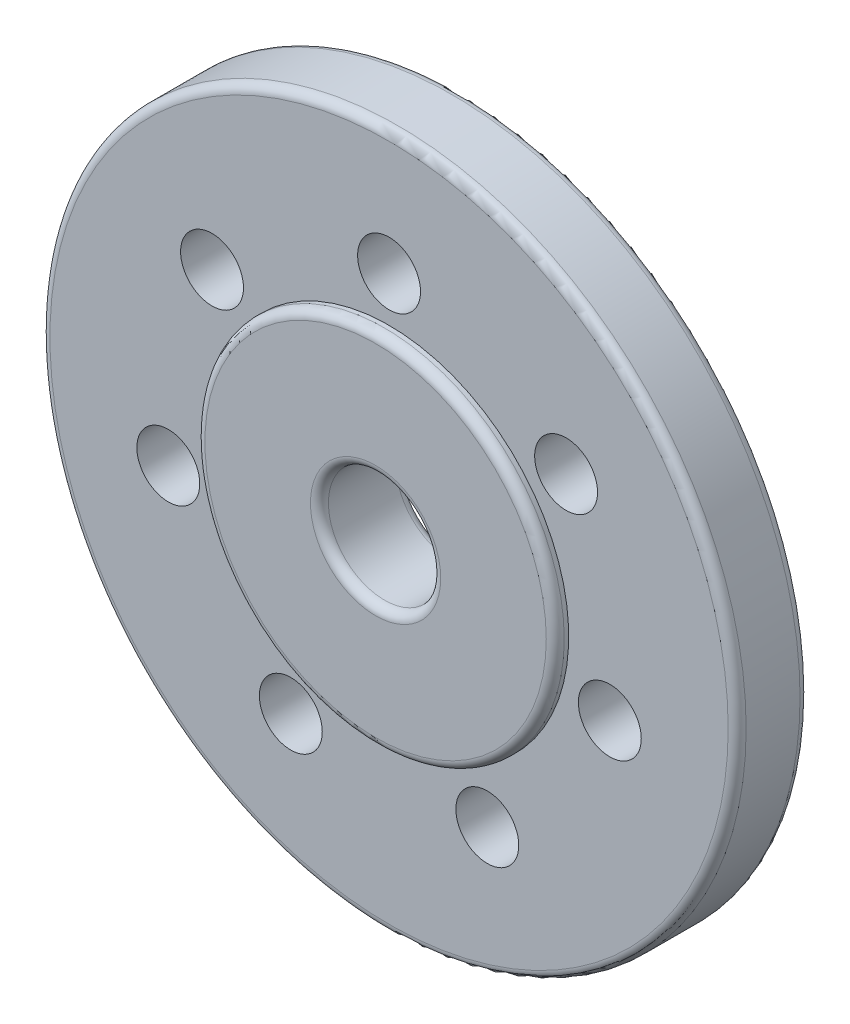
SolidWorks part; units mm, degrees
ref_plane "Front Plane" through (0, 0, 0) normal (0, 0, 1) x (1, 0, 0)
ref_plane "Top Plane" through (0, 0, 0) normal (0, 1, 0) x (1, 0, 0)
ref_plane "Right Plane" through (0, 0, 0) normal (1, 0, 0) x (0, 0, -1)
sketch "Sketch1" plane through (0, 0, 0) normal (0, 0, 1) x (1, 0, 0)
  line L0 (0, 0) -> (0, 106.7636) construction
  circle A0 centre (0, 0) radius 98.425
  dimension "D1" = 196.85
extrude "Boss-Extrude1" add sketch "Sketch1" along normal blind 20.32
sketch "Sketch2" plane through (0, 0, 20.32) normal (0, 0, 1) x (1, 0, 0)
  line L0 (0, 98.425) -> (0, -98.425) construction
  circle A0 centre (0, 0) radius 98.425 construction
  circle A1 centre (0, 63.5) radius 8.89
  dimension "D2" = 17.78
  dimension "D1" = 63.5
extrude "Cut-Extrude1" cut sketch "Sketch2" against normal blind 26.67
pattern_circular "CirPattern1" count 7 over 360 about axis through (0, -0.5223, 0) along (0, 0, 1) of "Cut-Extrude1"
fillet "Fillet1" radius 2.54 2 edges at (98.425, 0, 0) (98.425, 0, 20.32)
sketch "Sketch6" plane through (0, 0, 20.32) normal (0, 0, 1) x (1, 0, 0)
  circle A0 centre (0, 0) radius 15.875
  dimension "2.0" = 31.75
ref_plane "Plane1" through (0, 0, 10.16) normal (0, 0, 1) x (1, 0, 0)
extrude "Cut-Extrude2" cut sketch "Sketch6" against normal through all
sketch "Sketch8" plane through (0, 0, 20.32) normal (0, 0, 1) x (1, 0, 0)
  circle A0 centre (0, 0) radius 15.875
  circle A1 centre (0, 0) radius 50.8
  dimension "D1" = 101.6
  dimension "D2" = 31.75
extrude "Boss-Extrude2" add sketch "Sketch8" along normal blind 3.81
fillet "Fillet2" radius 2.54 3 edges at (15.875, 0, 0) (50.8, 0, 24.13) (15.875, 0, 24.13)
